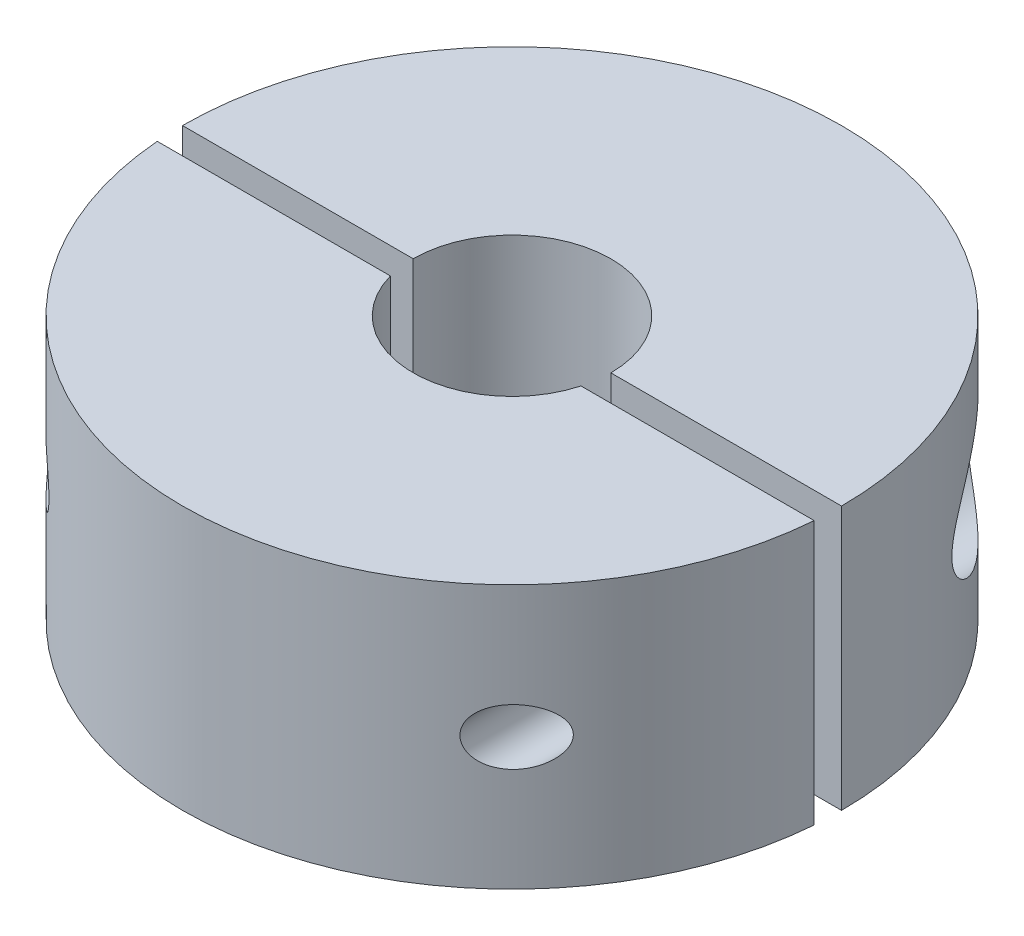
SolidWorks part; units mm, degrees
ref_plane "Front Plane" through (0, 0, 0) normal (0, 0, 1) x (1, 0, 0)
ref_plane "Top Plane" through (0, 0, 0) normal (0, 1, 0) x (1, 0, 0)
ref_plane "Right Plane" through (0, 0, 0) normal (1, 0, 0) x (0, 0, -1)
sketch "Sketch1" plane through (0, 0, 0) normal (0, 1, 0) x (1, 0, 0)
  circle A0 centre (0, 0) radius 15.875
  circle A1 centre (0, 0) radius 4.7625
  dimension "D1" = 31.75
  dimension "D2" = 9.525
extrude "Extrude1" add sketch "Sketch1" along normal blind 12.7
sketch "Sketch2" plane through (0, 12.7, 0) normal (0, 1, 0) x (-1, 0, 0)
  line L0 (0, 0) -> (21.9079, 0)
  line L1 (21.9079, 0) -> (21.9079, 1.2666)
  line L2 (21.9079, 1.2666) -> (-18.9524, 1.2666)
  line L3 (-18.9524, 1.2666) -> (-18.9524, 0)
  line L4 (-18.9524, 0) -> (0, 0)
  dimension "D1" = 1.2666
extrude "Cut-Extrude1" cut sketch "Sketch2" against normal through all
ref_plane "Plane1" through (0, 0, -6.35) normal (0, 0, 1) x (1, 0, 0)
sketch "Sketch3" plane through (0, 0, 0) normal (0, 0, 1) x (1, 0, 0)
  line L0 (-15.8244, 12.7) -> (-15.8244, 0) construction
  line L1 (15.8244, 0) -> (15.8244, 12.7) construction
  circle A0 centre (11.2524, 6.35) radius 1.778
  circle A1 centre (-11.2524, 6.35) radius 1.778
  dimension "D1" = 3.556
  dimension "D2" = 4.572
  dimension "D3" = 4.572
extrude "Cut-Extrude2" cut sketch "Sketch3" against normal blind 12.7
sketch "Sketch4" plane through (0, 0, -6.35) normal (0, 0, 1) x (1, 0, 0)
  circle A0 centre (11.2524, 6.35) radius 3.048
  circle A1 centre (-11.2524, 6.35) radius 3.048
  dimension "D1" = 6.096
  dimension "D2" = 6.096
extrude "Cut-Extrude3" cut sketch "Sketch4" against normal blind 12.7
sketch "Sketch5" plane through (0, 0, 1.2666) normal (0, 0, -1) x (-1, 0, 0)
  point P0 (-11.2524, 6.35)
  point P1 (11.2524, 6.35)
hole_wizard "#6-32 Tapped Hole1" positions "3DSketch1" profile "Sketch6" tap size "#6-32" standard "Ansi Inch"
sketch3d "3DSketch1"
  point P0 (11.2524, 6.35, 1.2666)
  point P3 (-11.2524, 6.35, 1.2666)
sketch "Sketch6" plane through (11.2524, 6.35, 1.2666) normal (1, 0, 0) x (0, 1, 0)
  line L0 (0, 0) -> (0, 11.9887)
  line L1 (0, 11.9887) -> (1.3525, 11.176)
  line L2 (1.3525, 11.176) -> (1.3525, 0)
  line L5 (1.3525, 0) -> (0, 0)
  line L10 (0, 11.9887) -> (-1.3526, 11.176) construction
  line L11 (0, -6.35) -> (0, 107.95) construction
  dimension "Tap Drill Dia." = 2.7051
  dimension "Tap Drill Depth" = 11.176
  dimension "Drill Angle" = 118
